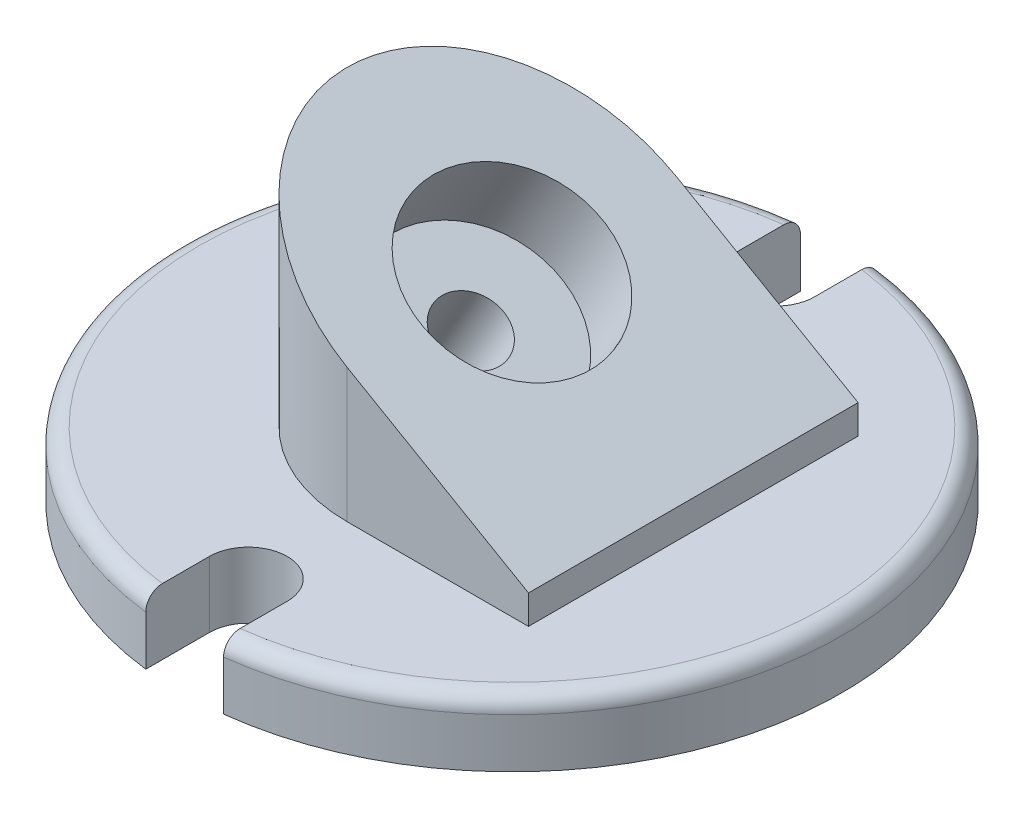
SolidWorks part; units mm, degrees
ref_plane "Front" through (0, 0, 0) normal (0, 0, 1) x (1, 0, 0)
ref_plane "Top" through (0, 0, 0) normal (0, 1, 0) x (1, 0, 0)
ref_plane "Right" through (0, 0, 0) normal (1, 0, 0) x (0, 0, -1)
sketch "Sketch1" plane through (0, 0, 0) normal (0, 1, 0) x (1, 0, 0)
  line L0 (7.493, 63.0564) -> (7.493, 50.8)
  line L1 (-7.493, 63.0564) -> (-7.493, 50.8)
  line L2 (0, 0) -> (63.5, 0) construction
  line L3 (-7.493, -63.0564) -> (-7.493, -50.8)
  line L4 (7.493, -63.0564) -> (7.493, -50.8)
  arc A0 (-7.493, 63.0564) -> (-7.493, -63.0564) centre (0, 0) ccw
  arc A1 (7.493, 50.8) -> (-7.493, 50.8) centre (0, 50.8) cw
  arc A2 (7.493, -50.8) -> (-7.493, -50.8) centre (0, -50.8) ccw
  arc A3 (7.493, -63.0564) -> (7.493, 63.0564) centre (0, 0) ccw
  dimension "D1" = 127
  dimension "D3" = 50.8
  dimension "D2" = 14.986
extrude "Base-Extrude" add sketch "Sketch1" along normal blind 12.7
sketch "Sketch2" plane through (0, 0, 0) normal (0, -1, 0) x (1, 0, 0)
  line L0 (0, 0) -> (34.4303, 0) construction
  line L1 (34.925, 31.75) -> (34.925, -31.75)
  line L2 (34.925, -31.75) -> (0, -31.75)
  line L3 (34.925, 31.75) -> (0, 31.75)
  arc A0 (0, -31.75) -> (0, 31.75) centre (0, 0) cw
  point P5 (34.925, 0)
  dimension "D2" = 34.925
  dimension "D1" = 63.5
extrude "Boss-Extrude1" add sketch "Sketch2" against normal blind 18.288
ref_plane "Plane4" through (16.6502, 28.839, 0) normal (0.5, 0.866, 0) x (-0.866, 0.5, 0)
sketch "Sketch3" plane through (0, 18.288, 0) normal (0, 1, 0) x (-1, 0, 0)
  line L3 (-34.925, -31.75) -> (0, -31.75)
  line L4 (0, 31.75) -> (-34.925, 31.75)
  line L5 (-34.925, 31.75) -> (-34.925, -31.75)
  line L6 (-34.925, -31.75) -> (0, -31.75)
  line L7 (0, 31.75) -> (-34.925, 31.75)
  line L8 (-34.925, 31.75) -> (-34.925, -31.75)
  arc A1 (0, -31.75) -> (0, 31.75) centre (0, 0) ccw
  arc A2 (0, -31.75) -> (0, 31.75) centre (0, 0) ccw
  dimension "D1" = 0
extrude "Boss-Extrude2" add sketch "Sketch3" along normal up to surface (20.164 mm away)
fillet "Fillet1" radius 3.175 2 edges at (-63.5, 12.7, 0) (7.493, 6.35, 63.0564)
hole_wizard "Hole1" positions "Sketch5" profile "Sketch4" legacy
sketch "Sketch5" plane through (16.6502, 28.839, 0) normal (0.5, 0.866, 0) x (-0.866, 0.5, 0)
  ellipse E0 centre (19.226, 0) end of major axis (-17.4358, 0) minor radius 31.75 (19.226, -31.75) -> (19.226, 31.75) ccw construction
  point P0 (19.226, 0)
sketch "Sketch4" plane through (0, 38.452, 0) normal (0, 0, 1) x (-0.866, 0.5, 0)
  line L0 (0, 0) -> (0, 100)
  line L1 (0, 100) -> (6.35, 100)
  line L2 (6.35, 100) -> (6.35, 15.875)
  line L3 (6.35, 15.875) -> (17.4625, 15.875)
  line L4 (17.4625, 15.875) -> (17.4625, 0)
  line L5 (17.4625, 0) -> (0, 0)
  line L6 (0, 110) -> (0, -10) construction
  dimension "Diameter" = 12.7
  dimension "Depth" = 100
  dimension "C-Bore Diameter" = 34.925
  dimension "C-Bore Depth" = 15.875
